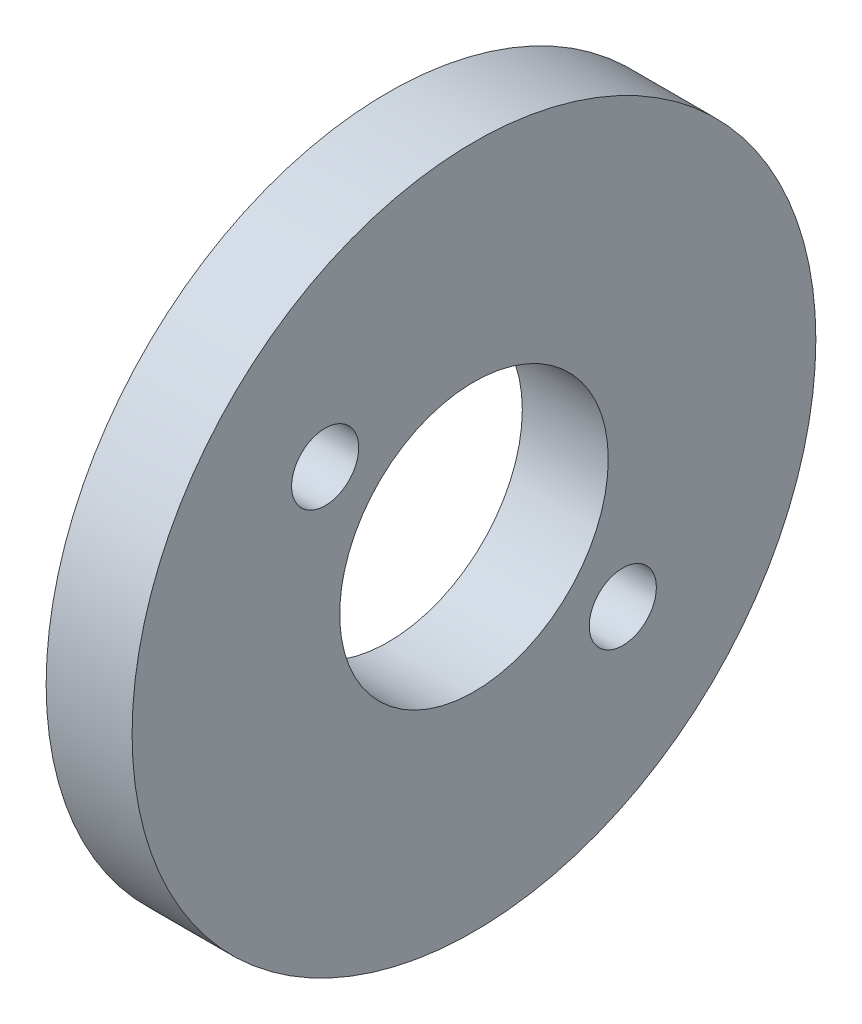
SolidWorks part; units mm, degrees
ref_plane "Plane1" through (0, 0, 0) normal (0, 0, 1) x (1, 0, 0)
ref_plane "Plane2" through (0, 0, 0) normal (0, 1, 0) x (1, 0, 0)
ref_plane "Plane3" through (0, 0, 0) normal (1, 0, 0) x (0, 0, -1)
imported_body "Imported1"
sketch "Sketch1" plane through (2.032, 0, 0) normal (1, 0, 0) x (0, 0, -1)
  circle A0 centre (0, 0) radius 6.35
  circle A1 centre (0, 0) radius 5.08 construction
  dimension "D1" = 12.7
extrude "Cut-Extrude1" cut sketch "Sketch1" against normal through all
